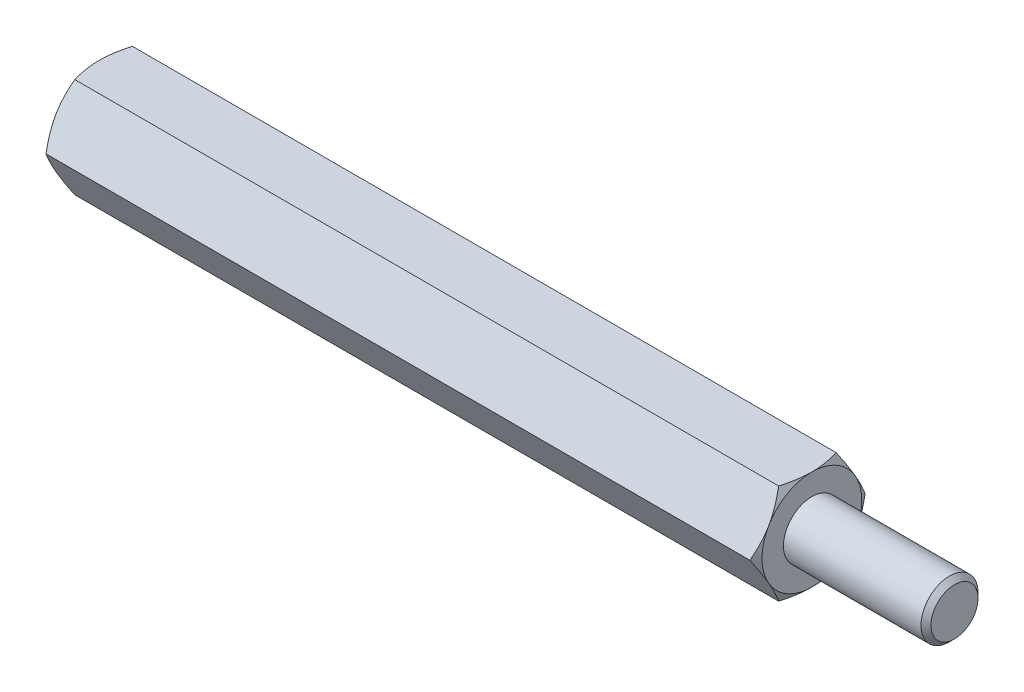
SolidWorks part; units mm, degrees
ref_plane "Front Plane" through (0, 0, 0) normal (0, 0, 1) x (1, 0, 0)
ref_plane "Top Plane" through (0, 0, 0) normal (0, 1, 0) x (1, 0, 0)
ref_plane "Right Plane" through (0, 0, 0) normal (1, 0, 0) x (0, 0, -1)
sketch "Sketch1" plane through (0, 0, 0) normal (1, 0, 0) x (0, 0, -1)
  line L1 (2.0207, 3.5) -> (-2.0207, 3.5)
  line L2 (-2.0207, 3.5) -> (-4.0415, 0)
  line L3 (-4.0415, 0) -> (-2.0207, -3.5)
  line L4 (-2.0207, -3.5) -> (2.0207, -3.5)
  line L5 (2.0207, -3.5) -> (4.0415, 0)
  line L6 (4.0415, 0) -> (2.0207, 3.5)
  circle A0 centre (0, 0) radius 3.5 construction
  dimension "D1" = 7
extrude "Extrude2" add sketch "Sketch1" along normal mid plane 50
sketch "Sketch2" plane through (0, 0, 0) normal (0, 0, 1) x (1, 0, 0)
  line L0 (-25, 3.5) -> (-23.5, 6.0981)
  line L1 (-25, 6.5) -> (-25, 3.5)
  line L3 (0, 0) -> (50000, 0) construction
  arc A0 (-23.5, 6.0981) -> (-25, 6.5) centre (-24.1962, 6.5) ccw
  dimension "D1" = 30
  dimension "D2" = 3
revolve "Cut-Revolve1" cut sketch "Sketch2" angle 360 about L3
mirror "Mirror1" about plane through (0, 0, 0) normal (1, 0, 0) of "Cut-Revolve1"
sketch "Sketch3" plane through (-25, 0, 0) normal (-1, 0, 0) x (0, 0, 1)
  circle A0 centre (0, 0) radius 1.65
  dimension "D1" = 3.3
extrude "Extrude3" cut sketch "Sketch3" against normal blind 10
sketch "Sketch4" plane through (0, 0, 0) normal (0, 0, 1) x (1, 0, 0)
  line L0 (-15, 0) -> (-15, 1.65)
  line L1 (24.6874, 0) -> (-24.6874, 0) construction
  line L2 (-15, 1.65) -> (-14.0474, 0)
  line L3 (-14.0474, 0) -> (-15, 0)
  line L4 (-25, 1.75) -> (-25, -1.75) construction
  point P4 (-25, 0)
  dimension "D1" = 30
  dimension "D2" = 1.65
  dimension "D3" = 10
revolve "Cut-Revolve2" cut sketch "Sketch4" angle 360 about L3
sketch "Sketch5" plane through (25, 0, 0) normal (1, 0, 0) x (0, 0, -1)
  circle A0 centre (0, 0) radius 2
  dimension "D1" = 4
extrude "Extrude4" add sketch "Sketch5" along normal blind 10
chamfer "Chamfer1" distance 0.35 angle 45 1 edges at (35, 0, -2)
equation "\"D2@Sketch4\" = \"D1@Sketch3\"/2"
